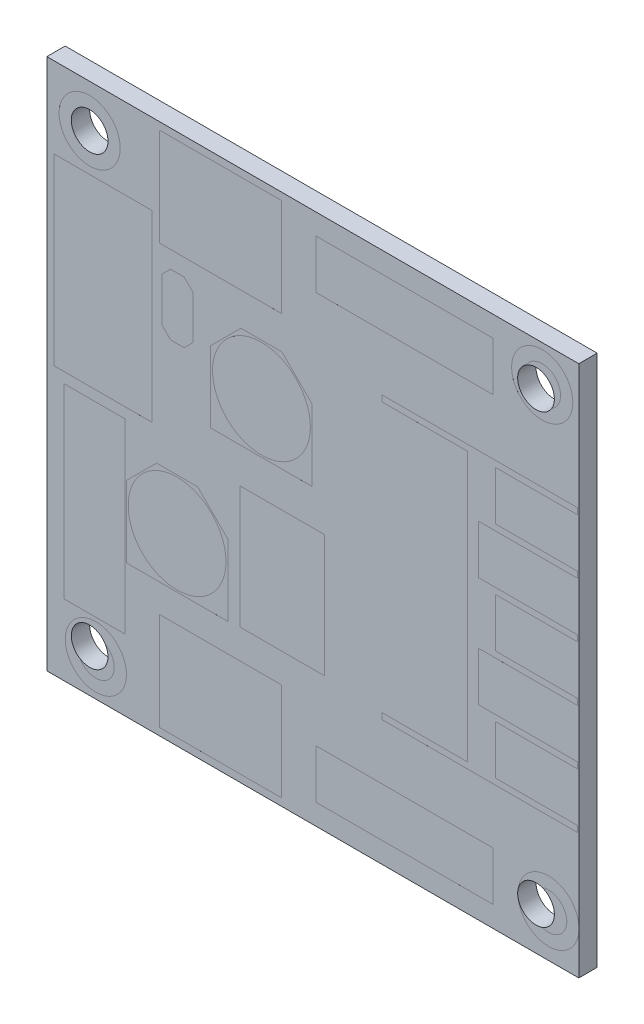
SolidWorks part; units mm, degrees
ref_plane "Front Plane" through (0, 0, 0) normal (0, 0, 1) x (1, 0, 0)
ref_plane "Top Plane" through (0, 0, 0) normal (0, 1, 0) x (1, 0, 0)
ref_plane "Right Plane" through (0, 0, 0) normal (1, 0, 0) x (0, 0, -1)
sketch "Sketch1" plane through (0, 0, 0) normal (0, 0, 1) x (1, 0, 0)
  line L1 (21.75, 21.75) -> (-21.75, 21.75)
  line L2 (21.75, 21.75) -> (21.75, -21.75)
  line L3 (21.75, -21.75) -> (-21.75, -21.75)
  line L4 (-21.75, 21.75) -> (-21.75, -21.75)
  line L5 (21.75, 21.75) -> (-21.75, -21.75) construction
  line L6 (21.75, -21.75) -> (-21.75, 21.75) construction
  circle A0 centre (-18.25, 18.25) radius 1.5
  circle A1 centre (18.25, 18.25) radius 1.5
  circle A2 centre (18.25, -18.25) radius 1.5
  circle A3 centre (-18.25, -18.25) radius 1.5
  point P0 (0, 0)
  point P17 (0, -0.6399)
  dimension "D3" = 3
  dimension "D4" = 36.5
  dimension "D1" = 43.5
  dimension "D2" = 43.5
extrude "Boss-Extrude1" add sketch "Sketch1" along normal blind 1.5
sketch "Sketch2" plane through (0, 0, 1.5) normal (0, 0, 1) x (1, 0, 0)
  circle A0 centre (-18.25, 18.25) radius 1.5
  circle A1 centre (-18.25, 18.25) radius 2.5
  circle A2 centre (18.7589, 18.7589) radius 2.5
  circle A3 centre (18.7589, 18.7589) radius 1.5
  circle A4 centre (19.2679, -18.25) radius 2.5
  circle A5 centre (19.2679, -18.25) radius 1.5
  circle A6 centre (-17.7411, -18.7589) radius 2.5
  circle A7 centre (-17.7411, -18.7589) radius 1.5
  point P16 (0.5089, 0)
  dimension "D1" = 5
  dimension "D2" = 4
extrude "Cut-Extrude1" cut sketch "Sketch2" against normal blind 0.0001
sketch "Sketch3" plane through (0, 0, 0) normal (0, 0, -1) x (-1, 0, 0)
  circle A0 centre (-18.25, -18.25) radius 1.5
  circle A1 centre (-18.25, -18.25) radius 2.5
  circle A2 centre (-18.7589, 18.7589) radius 2.5
  circle A3 centre (-18.7589, 18.7589) radius 1.5
  circle A4 centre (18.25, 19.2679) radius 2.5
  circle A5 centre (18.25, 19.2679) radius 1.5
  circle A6 centre (18.7589, -17.7411) radius 2.5
  circle A7 centre (18.7589, -17.7411) radius 1.5
  point P16 (0, 0.5089)
  dimension "D1" = 5
  dimension "D2" = 4
extrude "Cut-Extrude2" cut sketch "Sketch3" against normal blind 0.002
sketch "Sketch4" plane through (0, 0, 1.5) normal (0, 0, 1) x (1, 0, 0)
  line L0 (21.65, 11) -> (14.95, 11)
  line L1 (21.65, 11.5) -> (5.65, 11.5)
  line L2 (21.65, 11.5) -> (21.65, 11)
  line L3 (21.65, -11.5) -> (5.65, -11.5)
  line L4 (5.65, 11.5) -> (5.65, -11.5)
  line L5 (12.65, 11.5) -> (12.65, -11.5)
  line L6 (14.95, 11) -> (14.95, 7)
  line L7 (21.75, -21.75) -> (21.75, -18.5484) construction
  line L8 (-21.75, -21.75) -> (21.75, -21.75) construction
  line L9 (14.95, 7) -> (21.65, 7)
  line L10 (21.65, 7) -> (21.65, 6.5)
  line L11 (21.65, 6.5) -> (13.55, 6.5)
  line L12 (13.55, 6.5) -> (13.55, 2.5)
  line L13 (13.55, 2.5) -> (21.65, 2.5)
  line L14 (21.65, 2.5) -> (21.65, 2)
  line L15 (21.65, 2) -> (14.95, 2)
  line L16 (14.95, -2) -> (21.65, -2)
  line L17 (21.65, -2) -> (21.65, -2.5)
  line L18 (21.65, -2.5) -> (13.55, -2.5)
  line L19 (13.55, -6.5) -> (21.65, -6.5)
  line L20 (14.95, 2) -> (14.95, -2)
  line L21 (13.55, -2.5) -> (13.55, -6.5)
  line L22 (14.95, -11) -> (21.65, -11)
  line L23 (14.95, -7) -> (14.95, -11)
  line L24 (21.65, -7) -> (14.95, -7)
  line L25 (21.65, -6.5) -> (21.65, -7)
  line L26 (21.65, -11) -> (21.65, -11.5)
  line L27 (5.65, 11) -> (12.65, 11)
  line L28 (5.65, -11) -> (12.65, -11)
  point P0 (13.65, 0)
  dimension "D1" = 16
  dimension "D2" = 23
  dimension "D3" = 0.1
  dimension "D4" = 10.25
  dimension "D5" = 9
  dimension "D6" = 6.7
  dimension "D7" = 4
  dimension "D8" = 0.5
  dimension "D9" = 0.5
  dimension "D10" = 8.1
  dimension "D11" = 4
  dimension "D12" = 2
  dimension "D13" = 2
extrude "Cut-Extrude4" cut sketch "Sketch4" against normal blind 0.0001 contours L26 L22 L23 L24 L25 L19 L21 L18 L17 L16 L20 L15 L14 L13 L12 L11 L10 L9 L6 L0 L2 L1 L5 L3 | L4 L27 L5 L1 | L28 L4 L3 L5
sketch "Sketch6" plane through (0, 0, 1.5) normal (0, 0, 1) x (1, 0, 0)
  line L0 (-21.75, 21.75) -> (-21.75, -21.75) construction
  line L1 (-13.15, 15.15) -> (-21.15, 15.15)
  line L2 (-13.15, 15.15) -> (-13.15, 0.15)
  line L3 (-13.15, 0.15) -> (-21.15, 0.15)
  line L4 (-21.15, 15.15) -> (-21.15, 0.15)
  line L5 (-13.15, 15.15) -> (-21.15, 0.15) construction
  line L6 (-13.15, 0.15) -> (-21.15, 15.15) construction
  line L7 (21.75, 21.75) -> (-21.75, 21.75) construction
  line L8 (6.4313, 0) -> (-5.8929, 0) construction
  line L9 (-2.55, 13.15) -> (-12.55, 13.15)
  line L10 (-2.55, 13.15) -> (-2.55, 21.15)
  line L11 (-2.55, 21.15) -> (-12.55, 21.15)
  line L12 (-12.55, 13.15) -> (-12.55, 21.15)
  line L13 (-2.55, 13.15) -> (-12.55, 21.15) construction
  line L14 (-2.55, 21.15) -> (-12.55, 13.15) construction
  line L15 (-2.55, -21.15) -> (-12.55, -21.15)
  line L16 (-12.55, -13.15) -> (-12.55, -21.15)
  line L17 (-2.55, -13.15) -> (-12.55, -13.15)
  line L18 (-2.55, -13.15) -> (-2.55, -21.15)
  point P0 (-17.15, 7.65)
  point P10 (-7.55, 17.15)
  dimension "D1" = 15
  dimension "D2" = 8
  dimension "D3" = 0.6
  dimension "D4" = 6.6
  dimension "D5" = 8
  dimension "D6" = 10
  dimension "D7" = 0.6
  dimension "D8" = 0.6
extrude "Cut-Extrude5" cut sketch "Sketch6" against normal blind 0.0001
sketch "Sketch8" plane through (0, 0, 1.5) normal (0, 0, 1) x (1, 0, 0)
  line L0 (-0.05, 7.98) -> (-2.52, 10.45)
  line L5 (-0.05, 10.45) -> (-8.35, 2.15) construction
  line L6 (-0.05, 2.15) -> (-8.35, 10.45) construction
  line L7 (-2.52, 10.45) -> (-5.88, 10.45)
  line L8 (-0.05, 7.98) -> (-0.05, 2.15)
  line L9 (-0.05, 2.15) -> (-8.35, 2.15)
  line L10 (-8.35, 7.98) -> (-8.35, 2.15)
  line L11 (-0.05, 10.45) -> (-8.35, 2.15) construction
  line L12 (-0.05, 2.15) -> (-8.35, 10.45) construction
  line L13 (-5.88, 10.45) -> (-8.35, 7.98)
  circle A0 centre (-4.2, 6.3) radius 4
  point P0 (-4.2, 6.3)
  dimension "D5" = 8
  dimension "D2" = 8.3
extrude "Cut-Extrude6" cut sketch "Sketch8" against normal blind 0.0001
sketch "Sketch9" plane through (0, 0, 1.5) normal (0, 0, 1) x (1, 0, 0)
  line L0 (21.75, 21.75) -> (-21.75, 21.75) construction
  line L1 (14.75, 16.05) -> (0.25, 16.05)
  line L2 (14.75, 16.05) -> (14.75, 20.05)
  line L3 (14.75, 20.05) -> (0.25, 20.05)
  line L4 (0.25, 16.05) -> (0.25, 20.05)
  line L5 (14.75, 16.05) -> (0.25, 20.05) construction
  line L6 (14.75, 20.05) -> (0.25, 16.05) construction
  line L7 (21.75, -21.75) -> (21.75, -18.5484) construction
  point P0 (7.5, 18.05)
  dimension "D1" = 4
  dimension "D2" = 14.5
  dimension "D3" = 1.7
  dimension "D4" = 7
extrude "Cut-Extrude7" cut sketch "Sketch9" against normal blind 0.0001
sketch "Sketch10" plane through (0, 0, 1.5) normal (0, 0, 1) x (1, 0, 0)
  line L0 (-21.75, -21.75) -> (21.75, -21.75) construction
  line L1 (-15.35, -0.71) -> (-20.35, -0.71)
  line L2 (-15.35, -0.71) -> (-15.35, -15.95)
  line L3 (-15.35, -15.95) -> (-20.35, -15.95)
  line L4 (-20.35, -0.71) -> (-20.35, -15.95)
  line L5 (-15.35, -0.71) -> (-20.35, -15.95) construction
  line L6 (-15.35, -15.95) -> (-20.35, -0.71) construction
  line L7 (-21.75, 21.75) -> (-21.75, -21.75) construction
  point P0 (-17.85, -8.33)
  dimension "D1" = 15.24
  dimension "D2" = 5.8
  dimension "D3" = 5
  dimension "D4" = 1.4
extrude "Cut-Extrude8" cut sketch "Sketch10" against normal blind 0.0001
sketch "Sketch11" plane through (0, 0, 1.5) normal (0, 0, 1) x (1, 0, 0)
  line L0 (-15.35, -15.95) -> (-15.35, -0.71) construction
  line L5 (-9.42, -2.55) -> (-12.78, -2.55)
  line L6 (-6.95, -5.02) -> (-6.95, -10.85)
  line L7 (0.25, -16.05) -> (14.75, -16.05)
  line L8 (14.75, -20.05) -> (14.75, -16.05)
  line L9 (0.25, -20.05) -> (14.75, -20.05)
  line L10 (0.25, -20.05) -> (0.25, -16.05)
  line L11 (-6.95, -10.85) -> (-15.25, -10.85)
  line L12 (-15.25, -5.02) -> (-15.25, -10.85)
  line L13 (-6.95, -2.55) -> (-15.25, -10.85) construction
  line L14 (-6.95, -10.85) -> (-15.25, -2.55) construction
  line L15 (-2.55, -13.15) -> (-12.55, -13.15) construction
  line L17 (-6.95, -5.02) -> (-9.42, -2.55)
  line L18 (-12.78, -2.55) -> (-15.25, -5.02)
  circle A0 centre (-11.1, -6.7) radius 4
  point P0 (-11.1, -6.7)
  dimension "D5" = 8
  dimension "D1" = 8.3
  dimension "D2" = 8.3
  dimension "D3" = 0.1
  dimension "D4" = 2.3
  dimension "D6" = 4
extrude "Cut-Extrude9" cut sketch "Sketch11" against normal blind 0.0001
sketch "Sketch12" plane through (0, 0, 1.5) normal (0, 0, 1) x (1, 0, 0)
  line L0 (-9.81, 11.04) -> (-10.52, 11.75)
  line L1 (-10.52, 11.75) -> (-11.64, 11.75)
  line L2 (-9.81, 11.04) -> (-9.81, 7.46)
  line L3 (-10.52, 6.75) -> (-11.64, 6.75)
  line L4 (-12.35, 11.04) -> (-12.35, 7.46)
  line L5 (-9.81, 11.75) -> (-12.35, 6.75) construction
  line L6 (-9.81, 6.75) -> (-12.35, 11.75) construction
  line L7 (-11.64, 11.75) -> (-12.35, 11.04)
  line L8 (-9.81, 7.46) -> (-10.52, 6.75)
  line L9 (-11.64, 6.75) -> (-12.35, 7.46)
  line L10 (-12.55, 13.15) -> (-2.55, 13.15) construction
  line L11 (-13.15, 0.15) -> (-13.15, 15.15) construction
  line L12 (-8.35, 7.98) -> (-8.35, 2.15) construction
  point P0 (-11.08, 9.25)
  dimension "D1" = 5
  dimension "D2" = 2.54
  dimension "D3" = 1.4
  dimension "D4" = 0.8
  dimension "D6" = 1.46
extrude "Cut-Extrude10" cut sketch "Sketch12" against normal blind 0.0001
sketch "Sketch13" plane through (0, 0, 1.5) normal (0, 0, 1) x (1, 0, 0)
  line L0 (-8.35, 2.15) -> (-0.05, 2.15) construction
  line L1 (0.95, -0.75) -> (-5.95, -0.75)
  line L2 (0.95, -0.75) -> (0.95, -10.75)
  line L3 (0.95, -10.75) -> (-5.95, -10.75)
  line L4 (-5.95, -0.75) -> (-5.95, -10.75)
  line L5 (0.95, -0.75) -> (-5.95, -10.75) construction
  line L6 (0.95, -10.75) -> (-5.95, -0.75) construction
  line L7 (-6.95, -10.85) -> (-6.95, -5.02) construction
  point P0 (-2.5, -5.75)
  dimension "D1" = 10
  dimension "D2" = 6.9
  dimension "D3" = 2.9
  dimension "D4" = 1
extrude "Cut-Extrude11" cut sketch "Sketch13" against normal blind 0.0001
